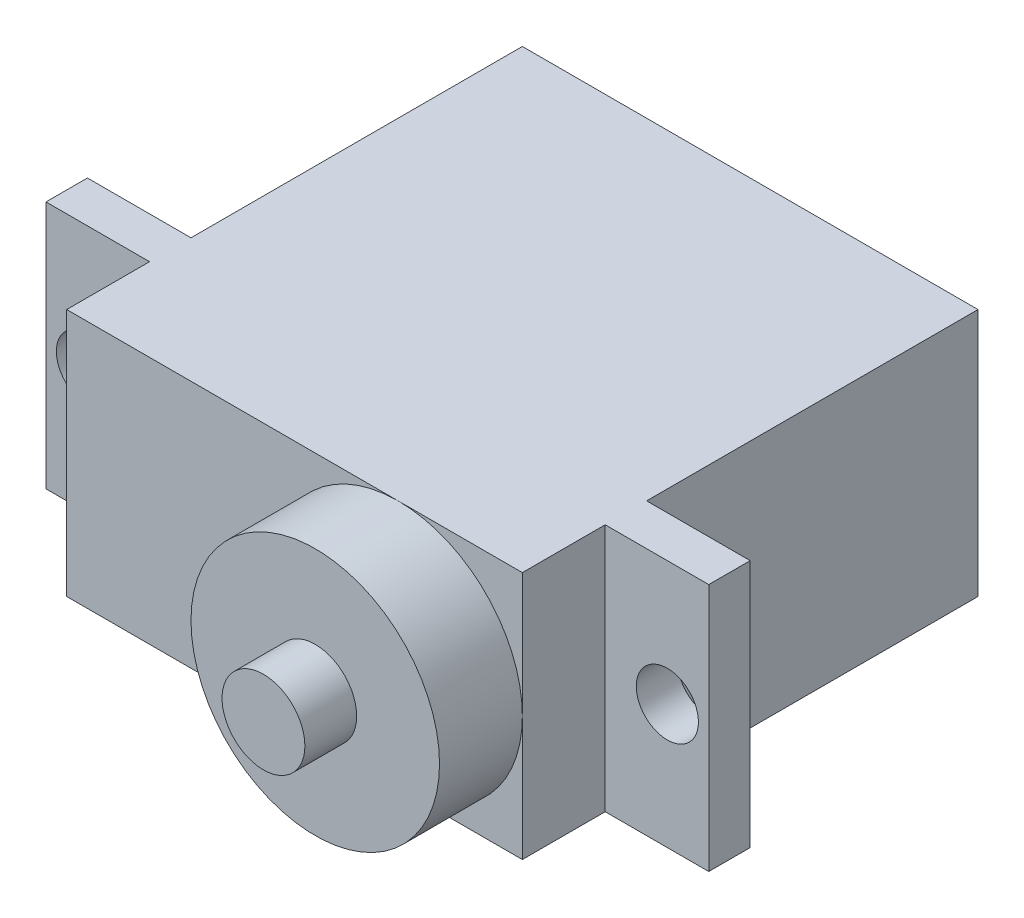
SolidWorks part; units mm, degrees
ref_plane "Plan de face" through (0, 0, 0) normal (0, 0, 1) x (1, 0, 0)
ref_plane "Plan de dessus" through (0, 0, 0) normal (0, 1, 0) x (1, 0, 0)
ref_plane "Plan de droite" through (0, 0, 0) normal (1, 0, 0) x (0, 0, -1)
sketch "Esquisse1" plane through (0, 0, 0) normal (0, 0, 1) x (1, 0, 0)
  line L1 (-17.8397, 8.3238) -> (4.1603, 8.3238)
  line L2 (-17.8397, 8.3238) -> (-17.8397, -3.6762)
  line L3 (-17.8397, -3.6762) -> (4.1603, -3.6762)
  line L4 (4.1603, 8.3238) -> (4.1603, -3.6762)
  dimension "D1" = 22
  dimension "D2" = 12
extrude "Boss.-Extru.1" add sketch "Esquisse1" along normal blind 22
sketch "Esquisse2" plane through (4.1603, 0, 0) normal (1, 0, 0) x (0, 0, -1)
  line L0 (-22, 8.3238) -> (0, 8.3238) construction
  line L1 (-18, 8.3238) -> (-16, 8.3238)
  line L2 (-18, 8.3238) -> (-18, -3.6762)
  line L3 (-18, -3.6762) -> (-16, -3.6762)
  line L4 (-16, 8.3238) -> (-16, -3.6762)
  line L5 (-22, -3.6762) -> (0, -3.6762) construction
  line L6 (-22, -3.6762) -> (-22, 8.3238) construction
  dimension "D1" = 4
  dimension "D2" = 2
extrude "Boss.-Extru.2" add sketch "Esquisse2" along normal blind 5
sketch "Esquisse3" plane through (-17.8397, 0, 0) normal (-1, 0, 0) x (0, 0, 1)
  line L0 (22, 8.3238) -> (0, 8.3238) construction
  line L1 (18, 8.3238) -> (16, 8.3238)
  line L2 (18, 8.3238) -> (18, -3.6762)
  line L3 (18, -3.6762) -> (16, -3.6762)
  line L4 (16, 8.3238) -> (16, -3.6762)
  line L5 (22, -3.6762) -> (0, -3.6762) construction
  line L6 (22, 8.3238) -> (22, -3.6762) construction
  dimension "D1" = 2
  dimension "D2" = 4
extrude "Boss.-Extru.3" add sketch "Esquisse3" along normal blind 5
sketch "Esquisse4" plane through (0, 0, 22) normal (0, 0, 1) x (1, 0, 0)
  line L0 (4.1603, -3.6762) -> (4.1603, 8.3238) construction
  line L1 (4.1603, 8.3238) -> (4.1603, -3.6762) construction
  circle A0 centre (-1.8397, 2.3238) radius 6
  circle A1 centre (-8.3397, 2.3238) radius 2.5
  point P4 (4.1603, 2.3238)
  dimension "D2" = 12
  dimension "D5" = 5
  dimension "D1" = 0
  dimension "D3" = 6
  dimension "D4" = 6.5
extrude "Boss.-Extru.4" add sketch "Esquisse4" along normal blind 4 contours A0
sketch "Esquisse5" plane through (0, 0, 26) normal (0, 0, 1) x (1, 0, 0)
  circle A0 centre (-1.8397, 2.3238) radius 2
  dimension "D1" = 4
extrude "Boss.-Extru.5" add sketch "Esquisse5" along normal blind 2.5
sketch "Esquisse6" plane through (0, 0, 18) normal (0, 0, 1) x (1, 0, 0)
  line L0 (9.1603, 8.3238) -> (9.1603, -3.6762) construction
  circle A0 centre (7.1603, 2.3238) radius 1.5
  dimension "D1" = 3
  dimension "D2" = 2
extrude "Enlèv. mat.-Extru.1" cut sketch "Esquisse6" against normal up to next
sketch "Esquisse7" plane through (0, 0, 18) normal (0, 0, 1) x (1, 0, 0)
  line L0 (-22.8397, -3.6762) -> (-22.8397, 8.3238) construction
  circle A0 centre (-20.8397, 2.3238) radius 1.5
  dimension "D1" = 3
  dimension "D2" = 2
extrude "Enlèv. mat.-Extru.2" cut sketch "Esquisse7" against normal up to next
